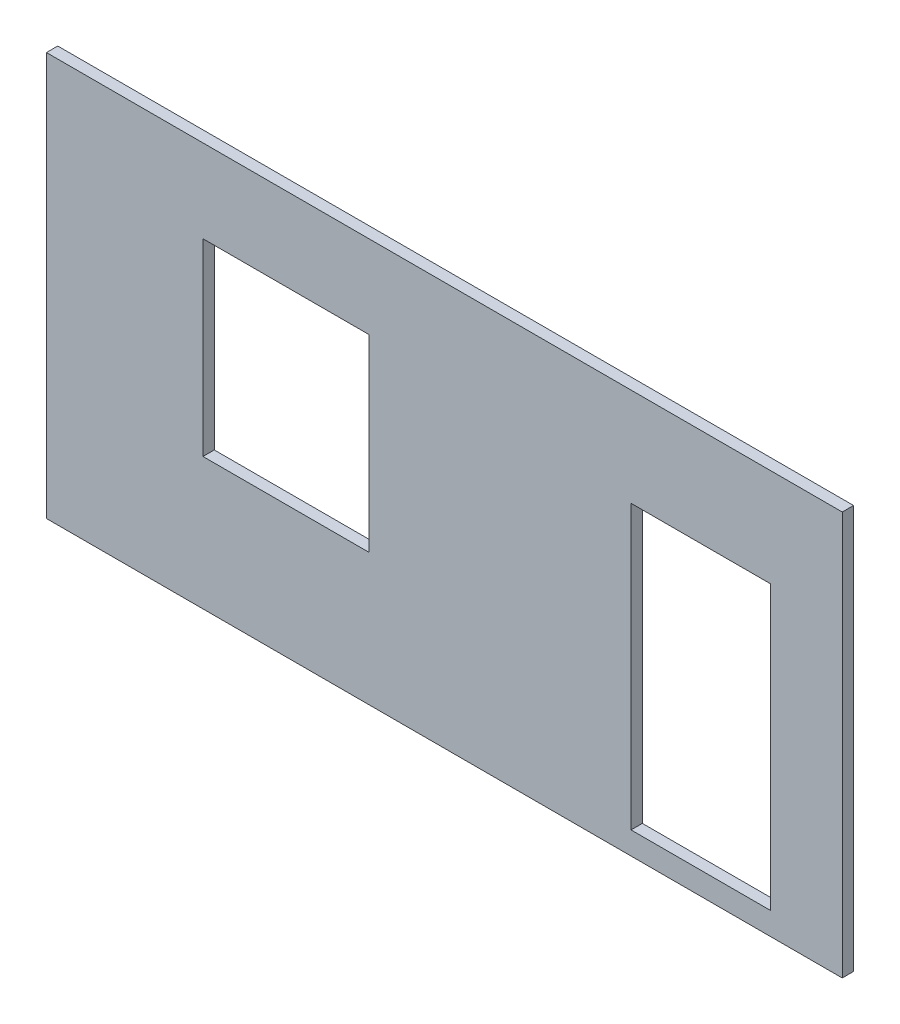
SolidWorks part; units mm, degrees
ref_plane "Plan de face" through (0, 0, 0) normal (0, 0, 1) x (1, 0, 0)
ref_plane "Plan de dessus" through (0, 0, 0) normal (0, 1, 0) x (1, 0, 0)
ref_plane "Plan de droite" through (0, 0, 0) normal (1, 0, 0) x (0, 0, -1)
sketch "Esquisse1" plane through (0, 0, 0) normal (0, 0, 1) x (1, 0, 0)
  line L1 (0, 0) -> (211, 0)
  line L2 (0, 0) -> (0, 107)
  line L3 (0, 107) -> (211, 107)
  line L4 (211, 0) -> (211, 107)
  dimension "D1" = 211
  dimension "D2" = 107
extrude "Extrusion1" add sketch "Esquisse1" along normal blind 3
sketch "Esquisse2" plane through (0, 0, 3) normal (0, 0, 1) x (1, 0, 0)
  line L0 (0, 107) -> (0, 0) construction
  line L1 (41.5, 35) -> (85.5, 35)
  line L2 (41.5, 35) -> (41.5, 85)
  line L3 (41.5, 85) -> (85.5, 85)
  line L4 (85.5, 35) -> (85.5, 85)
  line L5 (155, 6) -> (192, 6)
  line L6 (155, 6) -> (155, 81)
  line L7 (155, 81) -> (192, 81)
  line L8 (192, 6) -> (192, 81)
  line L9 (0, 0) -> (211, 0) construction
  line L10 (211, 0) -> (211, 107) construction
  dimension "D1" = 44
  dimension "D2" = 50
  dimension "D3" = 41.5
  dimension "D4" = 35
  dimension "D5" = 37
  dimension "D6" = 75
  dimension "D7" = 6
  dimension "D8" = 19
extrude "Enlèv. mat.-Extru.1" cut sketch "Esquisse2" against normal blind 3
